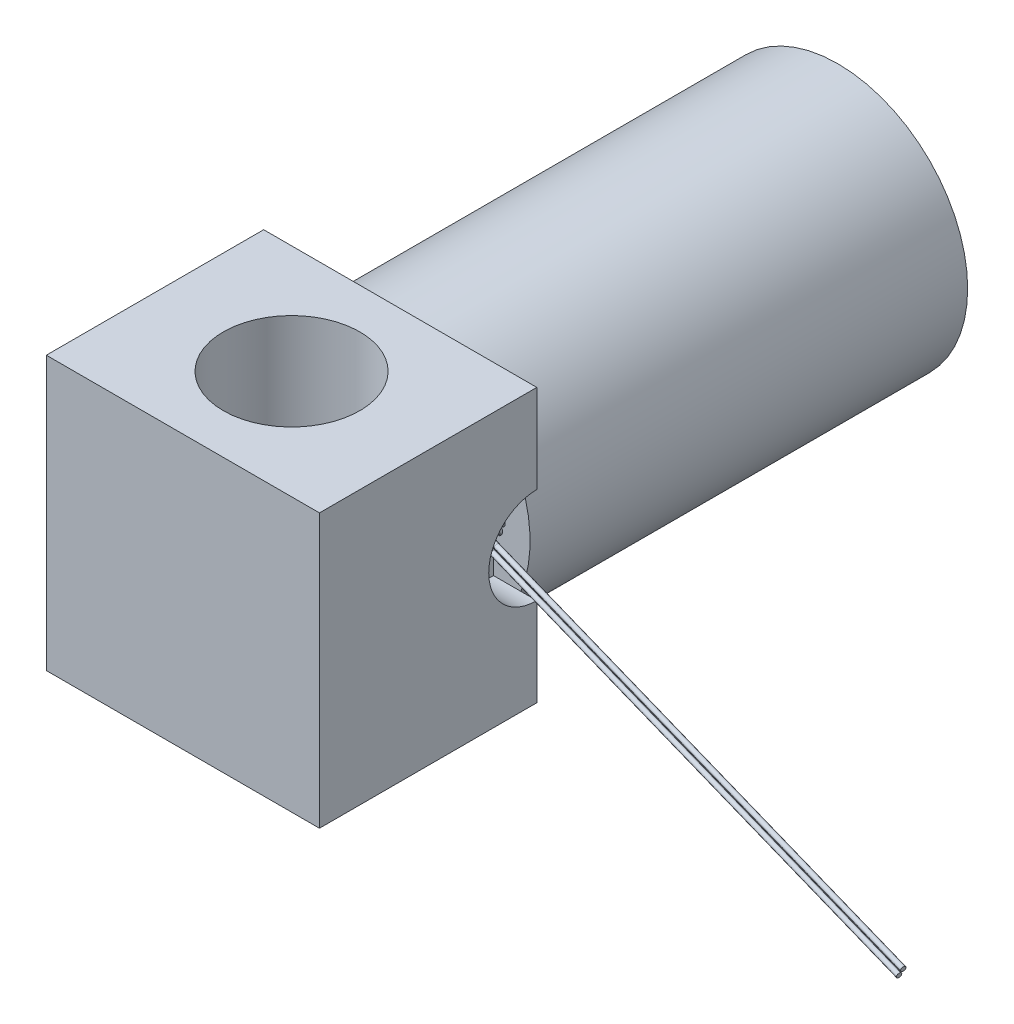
SolidWorks part; units mm, degrees
other "Defeature"
ref_plane "Front" through (0, 0, 0) normal (0, 0, 1) x (1, 0, 0)
ref_plane "Top" through (0, 0, 0) normal (0, 1, 0) x (1, 0, 0)
ref_plane "Right" through (0, 0, 0) normal (1, 0, 0) x (0, 0, -1)
imported_body "207-114-1-solid1"
imported_body "207-115-1-solid1"
imported_body "223-331-1-solid1"
imported_body "RX-102B-RS-leads-1-solid1"
imported_body "RX-102B-RS-leads-1-solid2"
imported_body "RX-102B-RS-leads-1-solid3"
sketch "Sketch1" plane through (0, 0, -11.557) normal (0, 0, -1) x (-1, 0, 0)
  circle A0 centre (0, 0) radius 3.429 construction
  circle A1 centre (0, 0) radius 3.429
extrude "Boss-Extrude1" add sketch "Sketch1" against normal up to surface (11.557 mm away)
